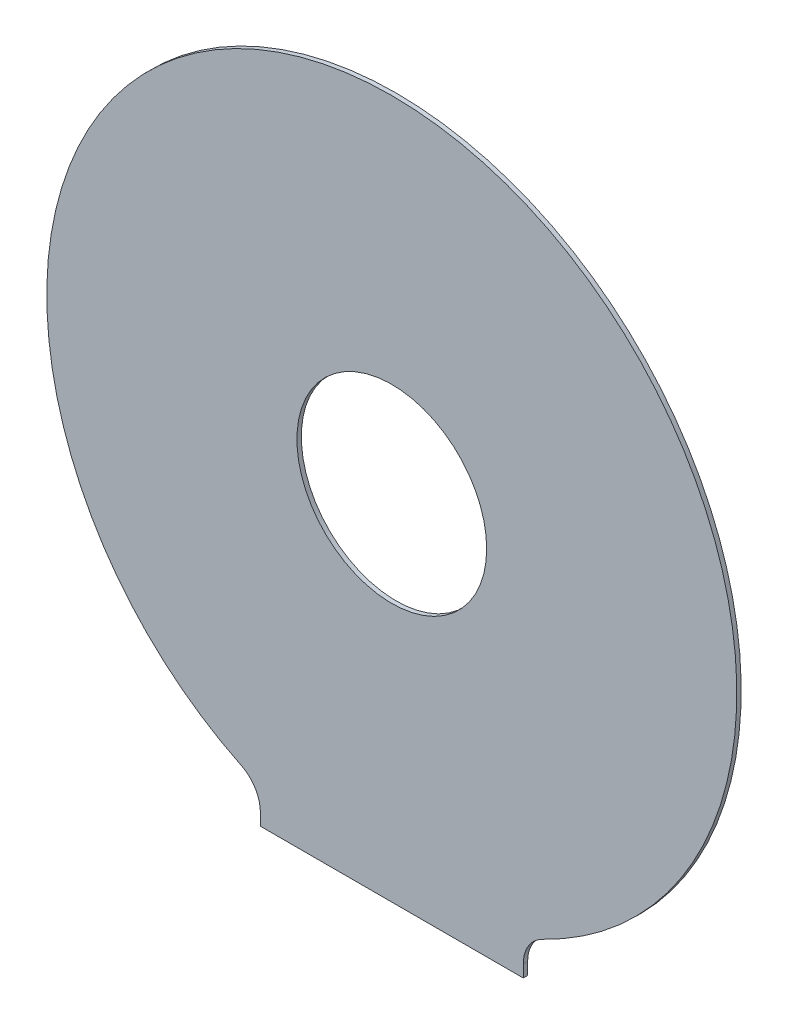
SolidWorks part; units mm, degrees
ref_plane "Front Plane" through (0, 0, 0) normal (0, 0, 1) x (1, 0, 0)
ref_plane "Top Plane" through (0, 0, 0) normal (0, 1, 0) x (1, 0, 0)
ref_plane "Right Plane" through (0, 0, 0) normal (1, 0, 0) x (0, 0, -1)
sketch "Sketch1" plane through (0, 0, 0) normal (0, 0, 1) x (1, 0, 0)
  line L677 (3.81, -10.2458) -> (3.81, -9.8926)
  line L678 (-3.81, -9.8926) -> (-3.81, -10.2458)
  line L679 (-3.81, -10.2458) -> (3.81, -10.2458)
  circle A266 centre (0, 0) radius 2.75
  arc A267 (4.3727, -8.9933) -> (3.81, -9.8926) centre (4.81, -9.8926) ccw
  arc A268 (4.3727, -8.9933) -> (-4.3727, -8.9933) centre (0, 0) ccw
  arc A269 (-3.81, -9.8926) -> (-4.3727, -8.9933) centre (-4.81, -9.8926) ccw
extrude "Boss-Extrude1" add sketch "Sketch1" along normal blind 0.127
